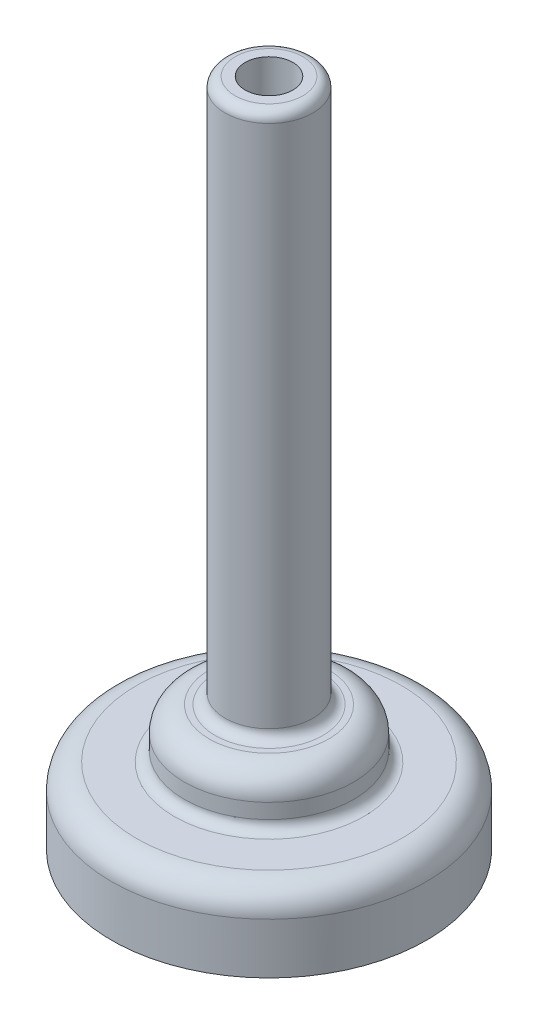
SolidWorks part; units mm, degrees
ref_plane "Front" through (0, 0, 0) normal (0, 0, 1) x (1, 0, 0)
ref_plane "Top" through (0, 0, 0) normal (0, 1, 0) x (1, 0, 0)
ref_plane "Right" through (0, 0, 0) normal (1, 0, 0) x (0, 0, -1)
sketch "Sketch1" plane through (0, 0, 0) normal (0, 0, 1) x (1, 0, 0)
  line L0 (0, 0) -> (0, 53.2601) construction
  line L1 (0, 0) -> (-10.033, 0)
  line L2 (-10.033, 0) -> (-10.033, 4.826)
  line L3 (-10.033, 4.826) -> (-5.3975, 4.826)
  line L4 (-5.3975, 4.826) -> (-5.3975, 8.001)
  line L5 (-5.3975, 8.001) -> (-2.794, 8.001)
  line L6 (-2.794, 8.001) -> (-2.794, 42.672)
  line L7 (-2.794, 42.672) -> (0, 42.672)
  line L8 (0, 42.672) -> (0, 0)
  dimension "D1" = 20.066
  dimension "D2" = 10.795
  dimension "D3" = 5.588
  dimension "D4" = 42.672
  dimension "D5" = 4.826
  dimension "D6" = 8.001
  dimension "D7" = 3.175
revolve "Base-Revolve" add sketch "Sketch1" angle 360 about L0
fillet "Fillet1" radius 1.5875 2 edges at (0, 4.826, -10.033) (0, 8.001, -5.3975)
shell "Shell1" thickness 1.27
sketch "Sketch2" plane through (0, 0, 0) normal (0, -1, 0) x (1, 0, 0)
  circle A0 centre (0, 0) radius 8.763 construction
  circle A1 centre (0, 0) radius 8.763
  circle A2 centre (0, 0) radius 8.255
  dimension "D1" = 16.51
extrude "Boss-Extrude1" add sketch "Sketch2" against normal up to surface (3.556 mm away)
fillet "Fillet2" radius 0.635 6 edges at (0, 6.731, 1.524) (0, 3.556, 4.1275) (0, 3.556, 8.255) (0, 4.826, -5.3975) (0, 8.001, -2.794) (0, 42.672, -2.794)
